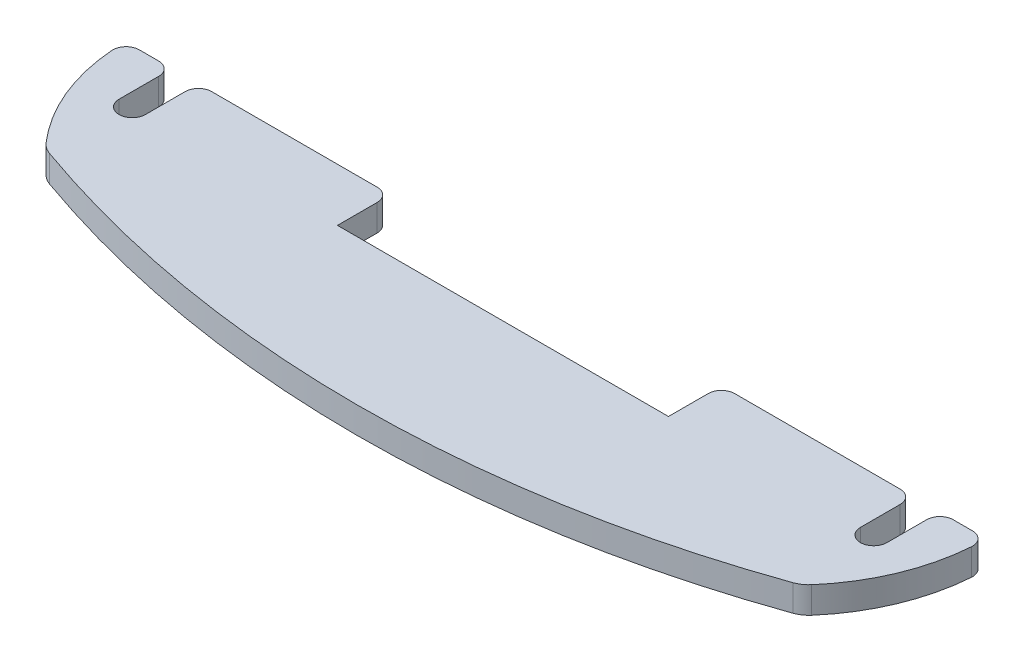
SolidWorks part; units mm, degrees
ref_plane "Plano frontal" through (0, 0, 0) normal (0, 0, 1) x (1, 0, 0)
ref_plane "Plano superior" through (0, 0, 0) normal (0, 1, 0) x (1, 0, 0)
ref_plane "Plano direito" through (0, 0, 0) normal (1, 0, 0) x (0, 0, -1)
sketch "Esboço1" plane through (0, 0, 0) normal (0, 1, 0) x (1, 0, 0)
  line L0 (-12.5, 0) -> (12.5, 0)
  line L1 (12.5, 0) -> (12.5, 3)
  line L2 (13.5, 4) -> (26, 4)
  line L3 (0, 0) -> (0, -12.0565) construction
  line L4 (28, 4) -> (28, 0) construction
  line L5 (29, 3) -> (29, 0)
  line L6 (27, 3) -> (27, 0)
  line L7 (30, 4) -> (31.4632, 4)
  line L8 (-28, 4) -> (-28, 0) construction
  line L9 (-30, 4) -> (-31.4632, 4)
  line L10 (-27, 3) -> (-27, 0)
  line L11 (-29, 3) -> (-29, 0)
  line L12 (-13.5, 4) -> (-26, 4)
  line L13 (-12.5, 0) -> (-12.5, 3)
  arc A0 (32.4605, 2.9266) -> (28.9071, -5.5993) centre (17.88, 4) cw
  arc A1 (28.067, -6.1711) -> (0, -11) centre (0, 72.9822) cw
  arc A2 (28.9071, -5.5993) -> (28.067, -6.1711) centre (27.3986, -4.2861) cw
  arc A3 (-28.067, -6.1711) -> (0, -11) centre (0, 72.9822) ccw
  arc A4 (27, 0) -> (29, 0) centre (28, 0) ccw
  arc A5 (-27, 0) -> (-29, 0) centre (-28, 0) cw
  arc A6 (-28.9071, -5.5993) -> (-28.067, -6.1711) centre (-27.3986, -4.2861) ccw
  arc A7 (-32.4605, 2.9266) -> (-28.9071, -5.5993) centre (-17.88, 4) ccw
  arc A8 (12.5, 3) -> (13.5, 4) centre (13.5, 3) cw
  arc A9 (-13.5, 4) -> (-12.5, 3) centre (-13.5, 3) cw
  arc A10 (27, 3) -> (26, 4) centre (26, 3) ccw
  arc A11 (-27, 3) -> (-26, 4) centre (-26, 3) cw
  arc A12 (-32.4605, 2.9266) -> (-31.4632, 4) centre (-31.4632, 3) cw
  arc A13 (31.4632, 4) -> (32.4605, 2.9266) centre (31.4632, 3) cw
  arc A14 (-30, 4) -> (-29, 3) centre (-30, 3) cw
  arc A15 (29, 3) -> (30, 4) centre (30, 3) cw
  point P12 (28.5451, -6)
  point P15 (29, 2.5)
  point P34 (-29, 2.5)
  point P35 (-28.5451, -6)
  point P38 (12.5, 4)
  point P41 (-12.5, 4)
  point P44 (27, 4)
  point P47 (-27, 4)
  point P50 (-32.5, 4)
  point P53 (32.5, 4)
  point P56 (-29, 4)
  point P59 (29, 4)
  dimension "D6" = 2
  dimension "D10" = 1
  dimension "D11" = 1
  dimension "D1" = 12.5
  dimension "D2" = 32.5
  dimension "D3" = 4
  dimension "D4" = 10
  dimension "D5" = 11
  dimension "D7" = 2
  dimension "D8" = 5
  dimension "D9" = 27
extrude "Ressalto-extrusão1" add sketch "Esboço1" along normal blind 2
